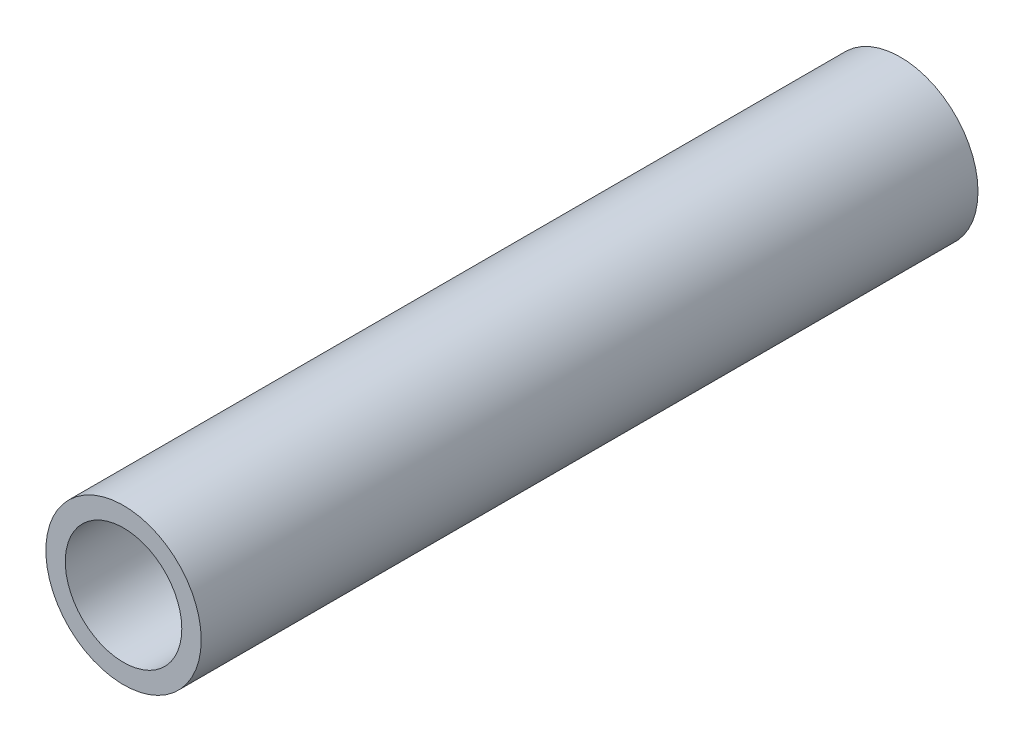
SolidWorks part; units mm, degrees
ref_plane "Front" through (0, 0, 0) normal (0, 0, 1) x (1, 0, 0)
ref_plane "Top" through (0, 0, 0) normal (0, 1, 0) x (1, 0, 0)
ref_plane "Right" through (0, 0, 0) normal (1, 0, 0) x (0, 0, -1)
sketch "Esquisse1" plane through (0, 0, 0) normal (0, 0, 1) x (1, 0, 0)
  circle A0 centre (0, 0) radius 2
  dimension "D1" = 4
extrude "Boss.-Extru.1" add sketch "Esquisse1" along normal blind 20
hole_wizard "Diamètre du perçage Ø0.15 (0.15)1" positions "Esquisse3" profile "Esquisse2" hole size "Ø0.15" standard "Ansi Metric"
sketch "Esquisse3" plane through (0, 0, 20) normal (0, 0, 1) x (1, 0, 0)
  point P0 (0, 0)
sketch "Esquisse2" plane through (0, 0, 20) normal (1, 0, 0) x (0, -1, 0)
  line L0 (0, 0) -> (0, 20)
  line L1 (0, 20) -> (1.5, 20)
  line L2 (1.5, 20) -> (1.5, 0)
  line L5 (1.5, 0) -> (0, 0)
  line L11 (0, -6.35) -> (0, 107.95) construction
  dimension "Diamètre du perçage jusqu'au prochain" = 3
  dimension "Profondeur du perçage jusqu'au prochain" = 20
